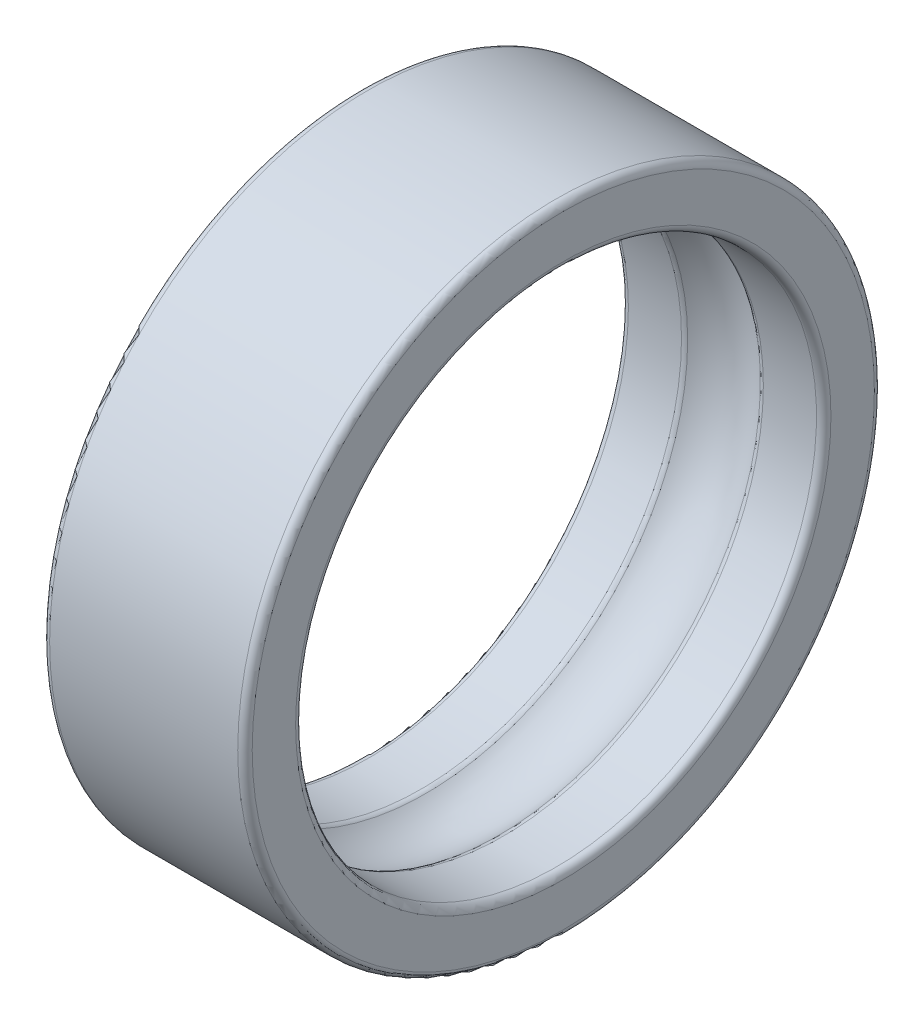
SolidWorks part; units mm, degrees
ref_plane "Face" through (0, 0, 0) normal (0, 0, 1) x (1, 0, 0)
ref_plane "Dessus" through (0, 0, 0) normal (0, 1, 0) x (1, 0, 0)
ref_plane "Droite" through (0, 0, 0) normal (1, 0, 0) x (0, 0, -1)
sketch "Esquisse1" plane through (0, 0, 0) normal (0, 0, 1) x (1, 0, 0)
  line L0 (-31.6677, 0) -> (38.3161, 0) construction
  line L1 (1.3229, 9) -> (3.5, 9)
  line L2 (-3.5, 9) -> (-1.3229, 9)
  line L3 (-3.5, 9) -> (-3.5, 11)
  line L4 (-3.5, 11) -> (3.5, 11)
  line L5 (3.5, 9) -> (3.5, 11)
  arc A0 (1.3229, 9) -> (-1.3229, 9) centre (0, 7.5) ccw
  dimension "D6" = 4
  dimension "D1" = 3.5
  dimension "D2" = 7
  dimension "D3" = 22
  dimension "D4" = 2
  dimension "D5" = 3.5
revolve "Révolution1" add sketch "Esquisse1" angle 360 about L0
fillet "Congé1" radius 0.25
